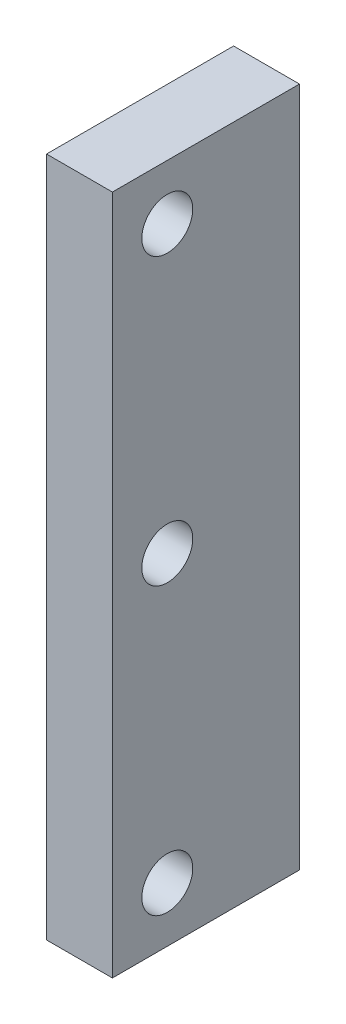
SolidWorks part; units mm, degrees
ref_plane "Front" through (0, 0, 0) normal (0, 0, 1) x (1, 0, 0)
ref_plane "Top" through (0, 0, 0) normal (0, 1, 0) x (1, 0, 0)
ref_plane "Right" through (0, 0, 0) normal (1, 0, 0) x (0, 0, -1)
sketch "Sketch1" plane through (0, 0, 0) normal (0, 1, 0) x (1, 0, 0)
  line L1 (0, 0) -> (3.81, 0)
  line L2 (0, 0) -> (0, 10.8204)
  line L3 (0, 10.8204) -> (3.81, 10.8204)
  line L4 (3.81, 0) -> (3.81, 10.8204)
  dimension "D1" = 10.8204
  dimension "D2" = 3.81
extrude "Extrude1" add sketch "Sketch1" along normal blind 39.37
hole_wizard "#32 (0.116) Diameter Hole1" positions "Sketch3" profile "Sketch2" hole size "#32" standard "Ansi Inch"
sketch "Sketch3" plane through (0, 0, 0) normal (-1, 0, 0) x (0, 0, 1)
  line L0 (0, 39.37) -> (0, 0) construction
  line L1 (-10.8204, 0) -> (0, 0) construction
  point P0 (-3.175, 3.175)
  dimension "D1" = 3.175
  dimension "D2" = 3.175
sketch "Sketch2" plane through (0, 3.175, -3.175) normal (0, 1, 0) x (0, 0, 1)
  line L0 (0, 0) -> (0, 3.81)
  line L1 (0, 3.81) -> (1.4732, 3.81)
  line L2 (1.4732, 3.81) -> (1.4732, 0)
  line L5 (1.4732, 0) -> (0, 0)
  line L11 (0, -6.35) -> (0, 107.95) construction
  dimension "Thru Hole Dia." = 2.9464
  dimension "Thru Hole Depth" = 3.81
pattern_linear "LPattern1" count 3 spacing 16.51 along (0, 1, 0) of "#32 (0.116) Diameter Hole1"
